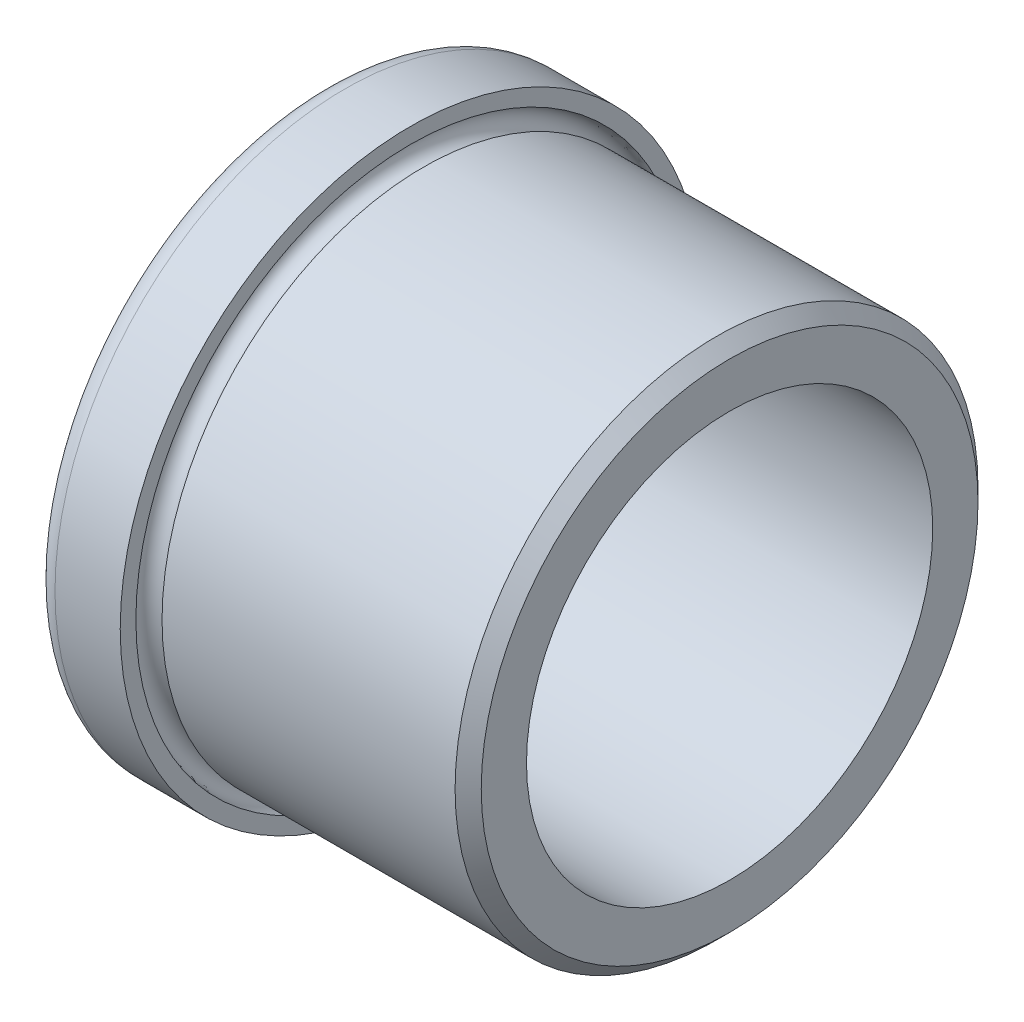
SolidWorks part; units mm, degrees
ref_plane "Plane1" through (0, 0, 0) normal (0, 0, 1) x (1, 0, 0)
ref_plane "Plane2" through (0, 0, 0) normal (0, 1, 0) x (1, 0, 0)
ref_plane "Plane3" through (0, 0, 0) normal (1, 0, 0) x (0, 0, -1)
sketch "Sketch1" plane through (0, 0, 0) normal (0, 0, 1) x (1, 0, 0)
  line L0 (0, 0) -> (76.2, 0) construction
  line L1 (0, 24.6126) -> (0, 29.3624)
  line L2 (2.3876, 31.75) -> (9.525, 31.75)
  line L3 (9.525, 31.75) -> (9.525, 30.0371)
  line L4 (10.9553, 28.6067) -> (43.0197, 28.6068)
  line L5 (43.0197, 28.6068) -> (44.45, 27.1764)
  line L6 (44.45, 27.1764) -> (44.45, 22.225)
  line L7 (44.45, 22.225) -> (2.3876, 22.225)
  line L8 (43.0197, -28.6068) -> (44.45, -27.1764) construction
  line L9 (44.45, -22.225) -> (0, -22.225) construction
  line L10 (10.9553, -28.6067) -> (43.0197, -28.6068) construction
  line L11 (0, -31.75) -> (9.525, -31.75) construction
  arc A0 (9.525, 30.0371) -> (10.9553, 28.6067) centre (9.525, 28.6068) ccw
  arc A1 (0, 24.6126) -> (2.3876, 22.225) centre (2.3876, 24.6126) ccw
  arc A2 (2.3876, 31.75) -> (0, 29.3624) centre (2.3876, 29.3624) ccw
  point P20 (0, 22.225)
  point P23 (0, 31.75)
  dimension "Head_radii" = 2.3876
  dimension "D1" = 1.4303
  dimension "Hole_dia" = 44.45
  dimension "Body_dia" = 57.2135
  dimension "Body_len" = 34.925
  dimension "Head_dia" = 63.5
  dimension "Head_ht" = 9.525
  dimension "D2" = 54.3528
  dimension "D3" = 45
revolve "BaseBody" add sketch "Sketch1" angle 360 about L0
equation "\"D1@Sketch1\" =  ( \"Body_dia@Sketch1\" -  ( \"Body_dia@Sketch1\" * .9 )  )  / 4"
equation "\"D2@Sketch1\" = \"Body_dia@Sketch1\" -  ( \"D1@Sketch1\" * 2 ) "
